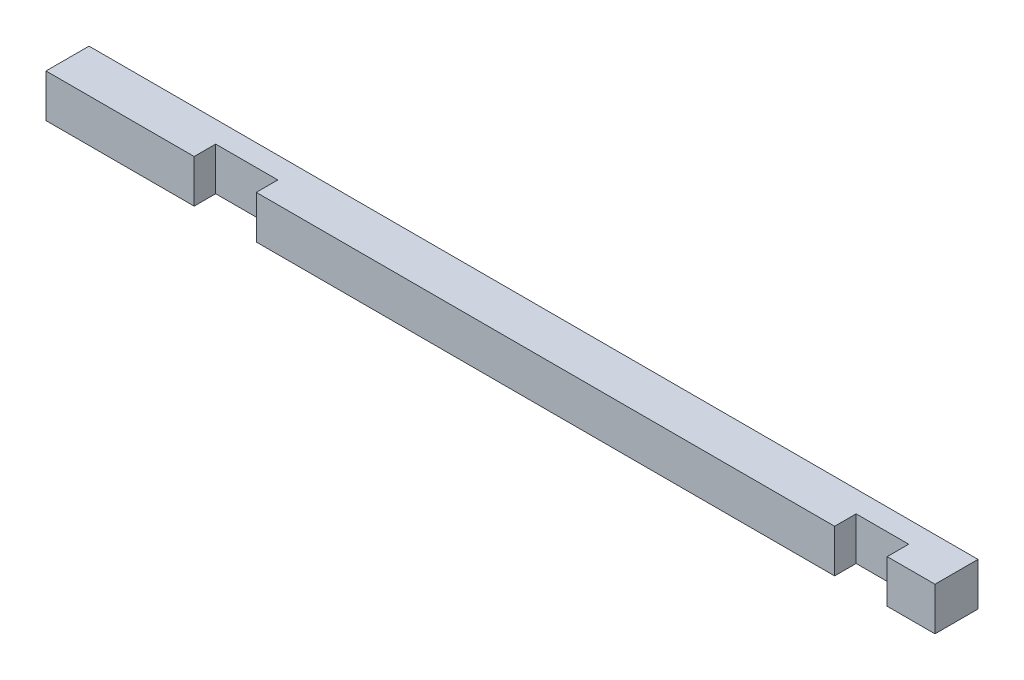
SolidWorks part; units mm, degrees
ref_plane "Plan de face" through (0, 0, 0) normal (0, 0, 1) x (1, 0, 0)
ref_plane "Plan de dessus" through (0, 0, 0) normal (0, 1, 0) x (1, 0, 0)
ref_plane "Plan de droite" through (0, 0, 0) normal (1, 0, 0) x (0, 0, -1)
sketch "Esquisse1" plane through (0, 0, 0) normal (0, 0, 1) x (1, 0, 0)
  line L1 (0, 0) -> (186, 0)
  line L2 (0, 0) -> (0, 9)
  line L3 (0, 9) -> (186, 9)
  line L4 (186, 0) -> (186, 9)
  dimension "D1" = 186
  dimension "D2" = 9
extrude "Extrusion1" add sketch "Esquisse1" along normal blind 9
sketch "Esquisse2" plane through (0, 0, 9) normal (0, 0, 1) x (1, 0, 0)
  line L0 (0, 0) -> (186, 0) construction
  line L1 (31, 0) -> (44, 0)
  line L2 (31, 0) -> (31, 9)
  line L3 (31, 9) -> (44, 9)
  line L4 (44, 0) -> (44, 9)
  line L5 (186, 9) -> (0, 9) construction
  line L7 (165, 0) -> (176, 0)
  line L8 (165, 0) -> (165, 9)
  line L9 (165, 9) -> (176, 9)
  line L10 (176, 0) -> (176, 9)
  dimension "D1" = 13
  dimension "D2" = 11
  dimension "D3" = 10
  dimension "D4" = 31
extrude "Enlèv. mat.-Extru.1" cut sketch "Esquisse2" against normal blind 4.5
